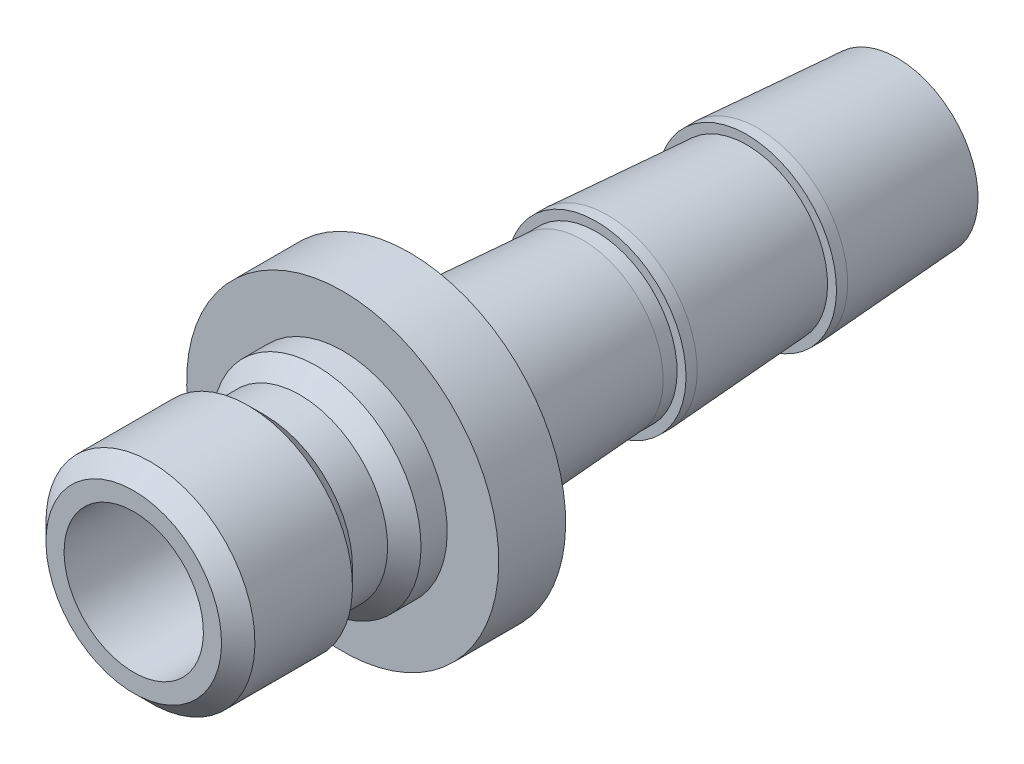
SolidWorks part; units mm, degrees
ref_plane "Front Plane" through (0, 0, 0) normal (0, 0, 1) x (1, 0, 0)
ref_plane "Top Plane" through (0, 0, 0) normal (0, 1, 0) x (1, 0, 0)
ref_plane "Right Plane" through (0, 0, 0) normal (1, 0, 0) x (0, 0, -1)
sketch "Sketch1" plane through (0, 0, 0) normal (1, 0, 0) x (0, 0, -1)
  line L0 (0, 0) -> (-12.7, 0) construction
  line L1 (-9.525, 3.175) -> (-9.525, 4.0005)
  line L2 (-3.556, 4.0005) -> (-3.556, 0) construction
  line L3 (-8.763, 4.7625) -> (-4.318, 4.7625)
  line L4 (0, 7.112) -> (0, 0) construction
  line L5 (-3.556, 4.0005) -> (-1.9558, 4.0005)
  line L6 (-1.1938, 4.7625) -> (0, 4.7625)
  line L7 (0, 4.7625) -> (0, 7.112)
  line L8 (-3.556, 4.0005) -> (-4.318, 4.7625)
  line L9 (-1.9558, 4.0005) -> (-1.1938, 4.7625)
  line L10 (-9.525, 4.0005) -> (-8.763, 4.7625)
  line L11 (-9.525, 3.175) -> (25.273, 3.175)
  line L12 (0, 7.112) -> (3.048, 7.112)
  line L13 (3.048, 7.112) -> (3.048, 4.0894)
  line L14 (3.048, 4.0894) -> (4.572, 4.0894)
  line L15 (0, 0) -> (28.0489, 0) construction
  line L16 (4.572, 4.0894) -> (10.922, 3.683)
  line L17 (18.923, 4.0894) -> (18.415, 4.0894)
  line L18 (10.922, 3.683) -> (11.557, 3.683)
  line L20 (12.065, 4.0894) -> (18.415, 3.683)
  line L22 (18.923, 4.0894) -> (25.273, 3.683)
  line L23 (25.273, 3.683) -> (25.273, 3.175)
  line L24 (18.415, 4.0894) -> (18.415, 3.683)
  line L25 (12.065, 4.0894) -> (11.557, 4.0894)
  line L26 (11.557, 4.0894) -> (11.557, 3.683)
  dimension "D1" = 9.525
  dimension "D2" = 1.6002
  dimension "D3" = 0.762
  dimension "D4" = 45
  dimension "D5" = 5.969
  dimension "D6" = 45
  dimension "D7" = 34.798
  dimension "D8" = 22.225
  dimension "D9" = 14.224
  dimension "D11" = 8.1788
  dimension "D12" = 6.35
  dimension "D13" = 6.35
  dimension "D14" = 9.525
  dimension "D15" = 0.508
  dimension "D16" = 1.524
  dimension "D17" = 7.366
revolve "Revolve1" add sketch "Sketch1" angle 360 about L0
